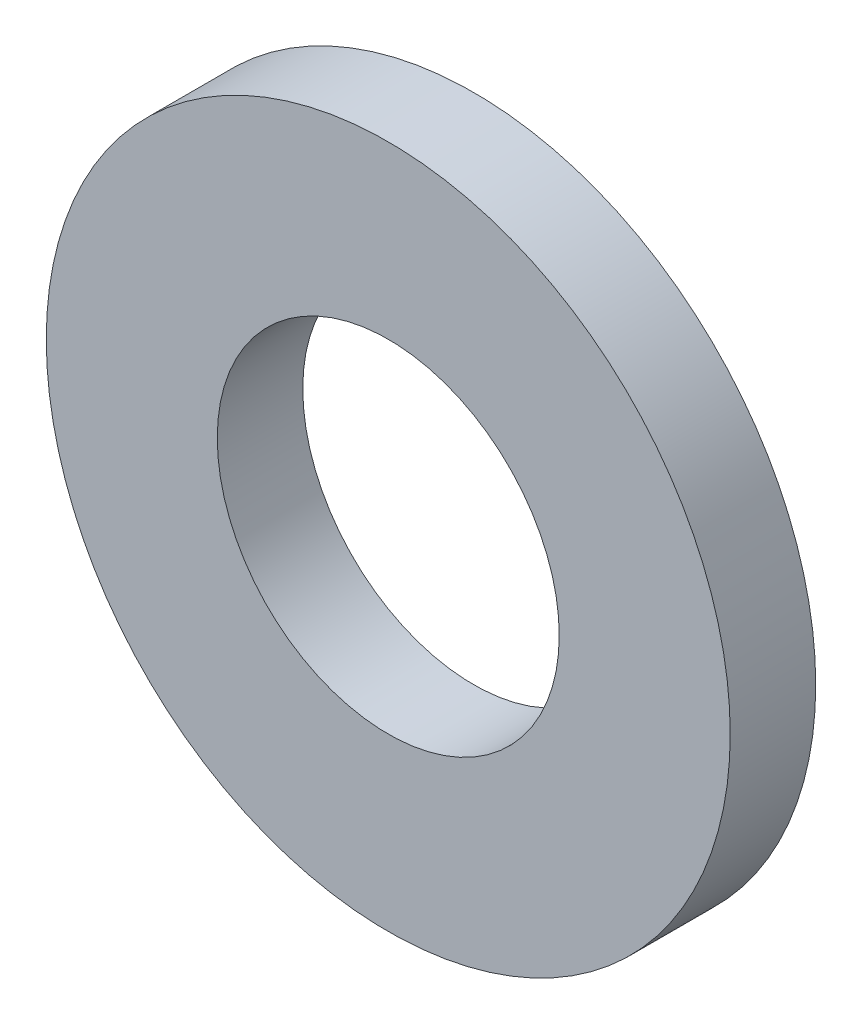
SolidWorks part; units mm, degrees
ref_plane "Front Plane" through (0, 0, 0) normal (0, 0, 1) x (1, 0, 0)
ref_plane "Top Plane" through (0, 0, 0) normal (0, 1, 0) x (1, 0, 0)
ref_plane "Right Plane" through (0, 0, 0) normal (1, 0, 0) x (0, 0, -1)
sketch "Sketch1" plane through (0, 0, 0) normal (0, 0, 1) x (1, 0, 0)
  circle A0 centre (0, 0) radius 4
  circle A1 centre (0, 0) radius 8
  dimension "D1" = 8
  dimension "D2" = 16
extrude "Boss-Extrude1" add sketch "Sketch1" along normal blind 2
